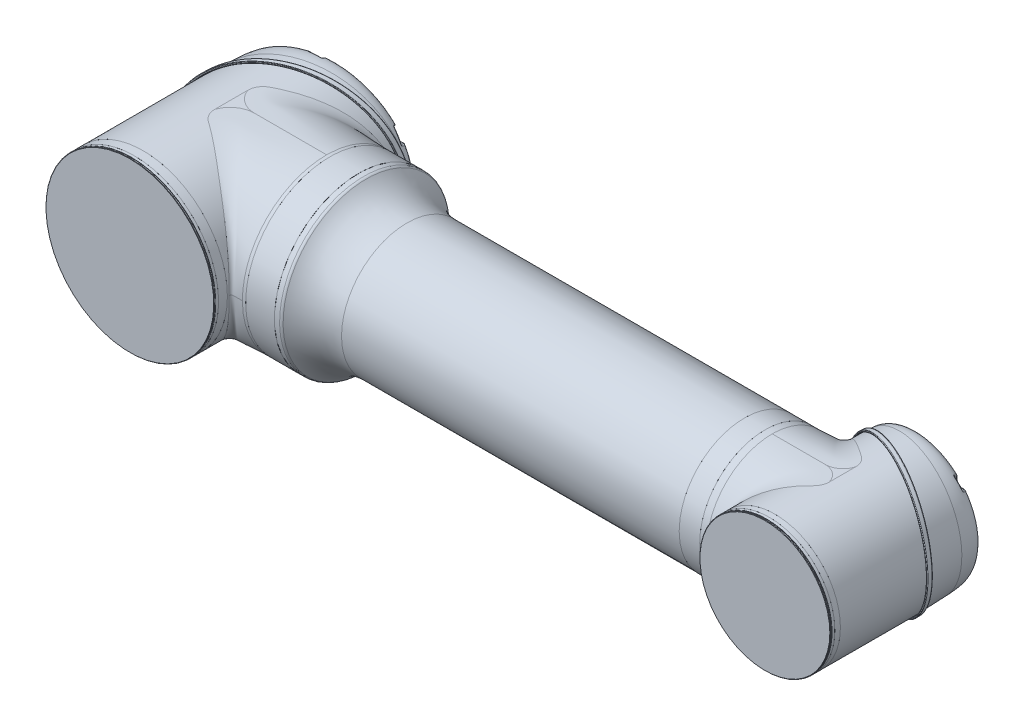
SolidWorks part; units mm, degrees
ref_plane "前视基准面" through (0, 0, 0) normal (0, 0, 1) x (1, 0, 0)
ref_plane "上视基准面" through (0, 0, 0) normal (0, 1, 0) x (1, 0, 0)
ref_plane "右视基准面" through (0, 0, 0) normal (1, 0, 0) x (0, 0, -1)
imported_body "CS612-Link1-1-solid1"
imported_body "CS612-Link1-1-solid2"
imported_body "CS612-Link1-1-solid3"
imported_body "CS612-J2-1-solid1"
imported_body "CS612-J2-1-solid2"
imported_body "CS612-J2-1-solid3"
imported_body "CS612-J2-1-solid4"
imported_body "CS612-J2-1-solid5"
imported_body "CS612-J2-1-solid6"
imported_body "CS612-J2-1-solid7"
imported_body "CS612-J2-1-solid8"
imported_body "CS612-J2-1-solid9"
imported_body "CS612-J2-1-solid10"
imported_body "CS612-J2-1-solid11"
imported_body "CS612-J2-1-solid12"
imported_body "CS612-J2-1-solid13"
imported_body "CS612-J2-1-solid14"
imported_body "CS612-J2-1-solid15"
imported_body "CS612-J2-1-solid16"
imported_body "CS612-J3-3-solid1"
imported_body "CS612-J3-3-solid2"
imported_body "CS612-J3-3-solid3"
imported_body "CS612-J3-3-solid4"
imported_body "CS612-J3-3-solid5"
imported_body "CS612-J3-3-solid6"
imported_body "CS612-J3-3-solid7"
imported_body "CS612-J3-3-solid8"
imported_body "CS612-J3-3-solid9"
imported_body "CS612-J3-3-solid10"
ref_plane "基准面1" through (300, 0, 0) normal (1, 0, 0) x (0, 0, -1)
split "分割1" trim tools "基准面1" bodies to split 108 resulting bodies 135 136
other "移动面1" parameters "D1"=63
move or copy body "实体-移动/复制1" bodies to move or copy 133 126 129 107 125 128 131 134 130 127 137 132 copy no translate (-63, 0, 0)
combine bodies "组合1" operation type add bodies to combine 136 148
